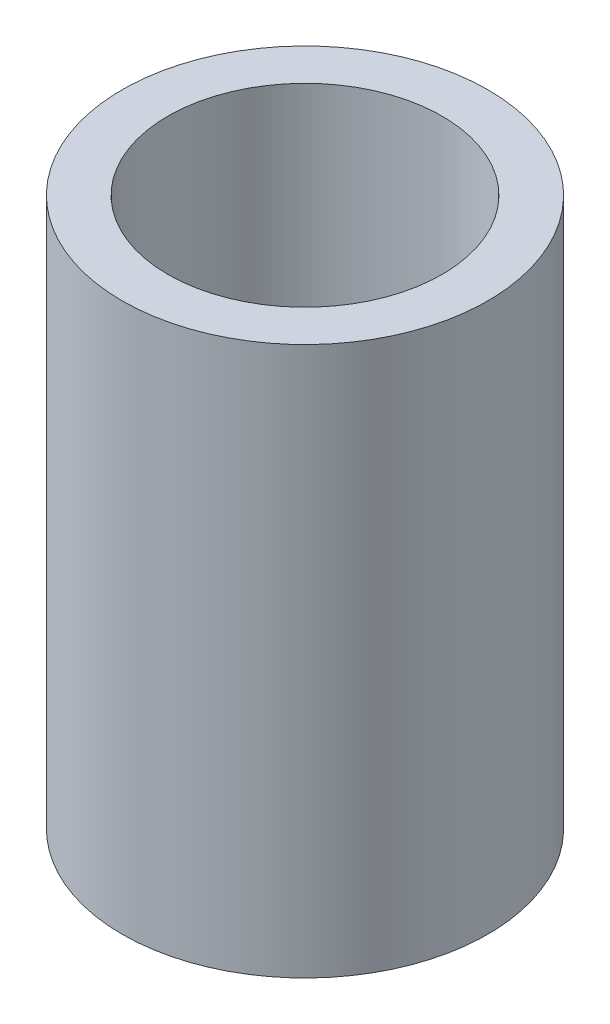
SolidWorks part; units mm, degrees
ref_plane "Front Plane" through (0, 0, 0) normal (0, 0, 1) x (1, 0, 0)
ref_plane "Top Plane" through (0, 0, 0) normal (0, 1, 0) x (1, 0, 0)
ref_plane "Right Plane" through (0, 0, 0) normal (1, 0, 0) x (0, 0, -1)
sketch "Sketch1" plane through (0, 0, 0) normal (0, 1, 0) x (1, 0, 0)
  circle A0 centre (0, 0) radius 1.5
  circle A1 centre (0, 0) radius 2
  dimension "D1" = 3
  dimension "D2" = 4
extrude "Boss-Extrude1" add sketch "Sketch1" along normal blind 6
sketch "Sketch2" plane through (0, 0, 0) normal (0, -1, 0) x (1, 0, 0)
  line L0 (0, 0) -> (0, 2) construction
  circle A0 centre (0, 0) radius 2 construction
